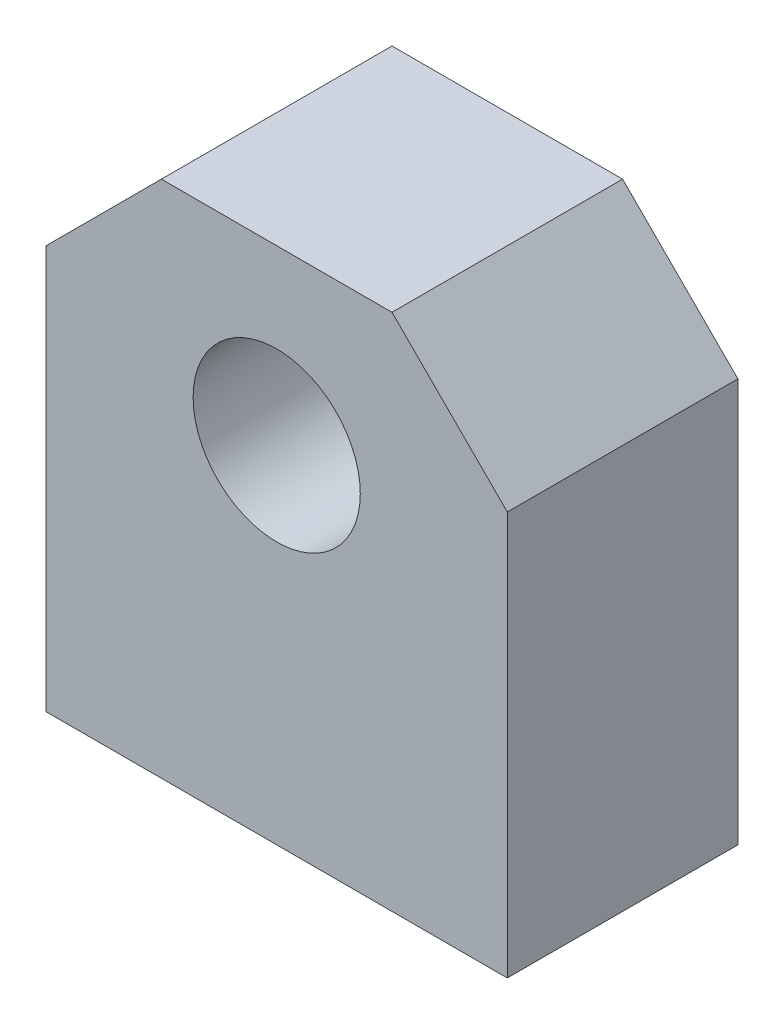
SolidWorks part; units mm, degrees
ref_plane "Plan de face" through (0, 0, 0) normal (0, 0, 1) x (1, 0, 0)
ref_plane "Plan de dessus" through (0, 0, 0) normal (0, 1, 0) x (1, 0, 0)
ref_plane "Plan de droite" through (0, 0, 0) normal (1, 0, 0) x (0, 0, -1)
sketch "Esquisse1" plane through (0, 0, 0) normal (0, 0, 1) x (1, 0, 0)
  line L0 (10, 15) -> (20, 5)
  line L1 (-20, -30) -> (20, -30)
  line L2 (-20, -30) -> (-20, 5)
  line L3 (-10, 15) -> (10, 15)
  line L4 (20, -30) -> (20, 5)
  line L5 (-20, 5) -> (-10, 15)
  circle A0 centre (0, 0) radius 7.25
  point P1 (20, 15)
  point P2 (-20, 15)
  dimension "D3" = 14.5
  dimension "D1" = 40
  dimension "D2" = 45
  dimension "D4" = 20
  dimension "D5" = 30
extrude "Extrusion1" add sketch "Esquisse1" along normal blind 20
hole_wizard "Trou taraudé M61" positions "Esquisse3D1" profile "Esquisse2" tap size "M6" standard "ISO"
sketch3d "Esquisse3D1"
  line L0 (-20, -30, 20) -> (-20, -30, 0) construction
  line L1 (-20, -30, 20) -> (20, -30, 20) construction
  line L2 (20, -30, 20) -> (20, -30, 0) construction
  point P0 (10, -30, 10)
  point P2 (-10, -30, 10)
  dimension "D1" = 10
  dimension "D2" = 10
  dimension "D3" = 10
sketch "Esquisse2" plane through (10, -30, 10) normal (1, 0, 0) x (0, 0, -1)
  line L0 (0, 0) -> (0, 26.5022)
  line L1 (0, 26.5022) -> (2.5, 25)
  line L2 (2.5, 25) -> (2.5, 0)
  line L5 (2.5, 0) -> (0, 0)
  line L10 (0, 26.5022) -> (-2.5, 25) construction
  line L11 (0, -6.35) -> (0, 107.95) construction
  dimension "Diamètre du trou pour taraudage" = 5
  dimension "Profondeur du trou pour taraudage" = 25
  dimension "Angle de pointe" = 118
